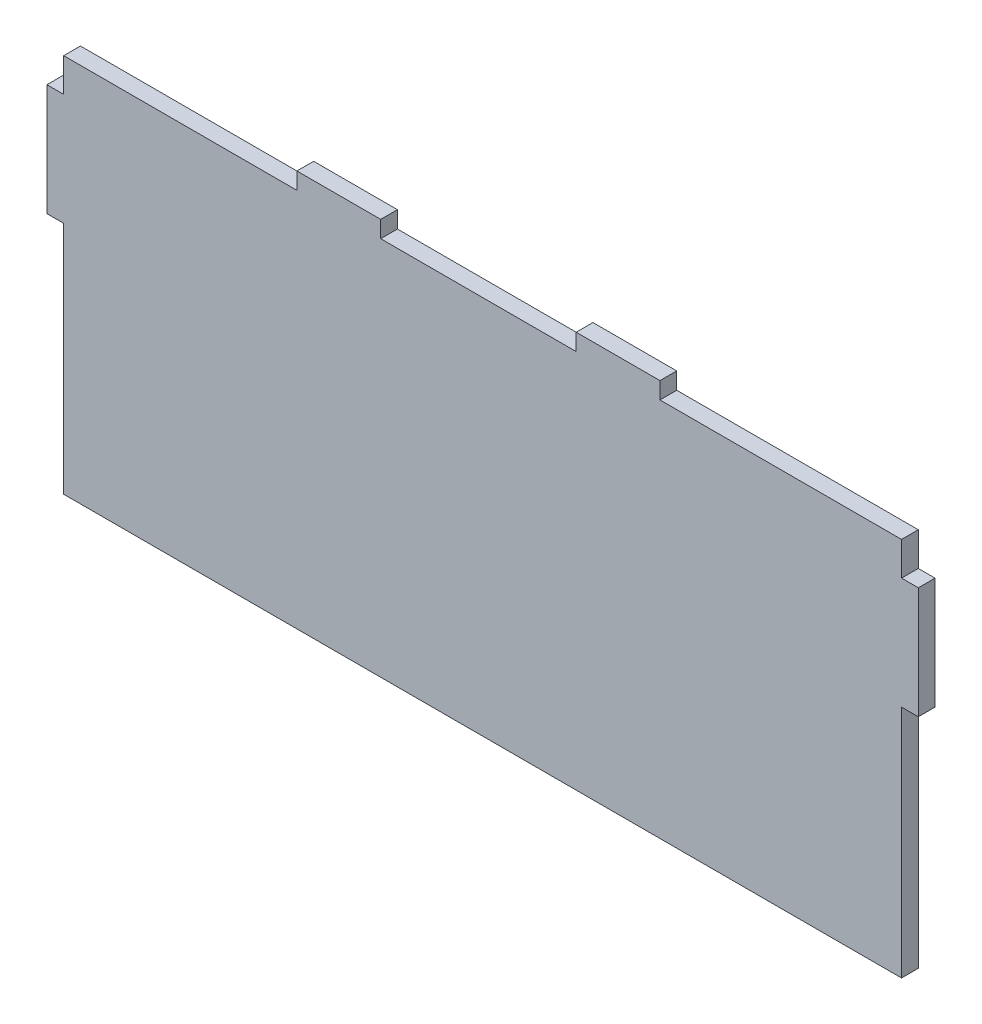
SolidWorks part; units mm, degrees
ref_plane "Front Plane" through (0, 0, 0) normal (0, 0, 1) x (1, 0, 0)
ref_plane "Top Plane" through (0, 0, 0) normal (0, 1, 0) x (1, 0, 0)
ref_plane "Right Plane" through (0, 0, 0) normal (1, 0, 0) x (0, 0, -1)
sketch "Croquis1" plane through (0, 0, 0) normal (0, 0, 1) x (1, 0, 0)
  line L0 (-166.25, 152.5) -> (-166.25, 167.5)
  line L1 (-375, 152.5) -> (-166.25, 152.5)
  line L2 (-375, 22.5) -> (-375, -187.5)
  line L3 (-375, -187.5) -> (375, -187.5)
  line L4 (375, 22.5) -> (375, -187.5)
  line L5 (-166.25, 167.5) -> (-91.25, 167.5)
  line L6 (-91.25, 167.5) -> (-91.25, 152.5)
  line L7 (83.75, 152.5) -> (83.75, 167.5)
  line L8 (83.75, 167.5) -> (158.75, 167.5)
  line L9 (158.75, 167.5) -> (158.75, 152.5)
  line L10 (-91.25, 152.5) -> (83.75, 152.5)
  line L11 (158.75, 152.5) -> (375, 152.5)
  line L15 (0, 152.5) -> (0, 927.6029) construction
  line L19 (-375, 122.5) -> (-375, 152.5)
  line L20 (375, 152.5) -> (375, 122.5)
  line L21 (-375, 122.5) -> (-390, 122.5)
  line L22 (-390, 122.5) -> (-390, 22.5)
  line L23 (-390, 22.5) -> (-375, 22.5)
  line L24 (390, 22.5) -> (375, 22.5)
  line L25 (390, 122.5) -> (390, 22.5)
  line L26 (375, 122.5) -> (390, 122.5)
  point P7 (-166.25, 160)
  dimension "D1" = 750
  dimension "D2" = 375
  dimension "D3" = 340
  dimension "D4" = 187.5
  dimension "D5" = 208.75
  dimension "D6" = 75
  dimension "D7" = 15
  dimension "D8" = 75
  dimension "D9" = 175
  dimension "D10" = 15
  dimension "D11" = 100
  dimension "D12" = 30
  dimension "D13" = 15
extrude "Saliente-Extruir1" add sketch "Croquis1" along normal blind 15
